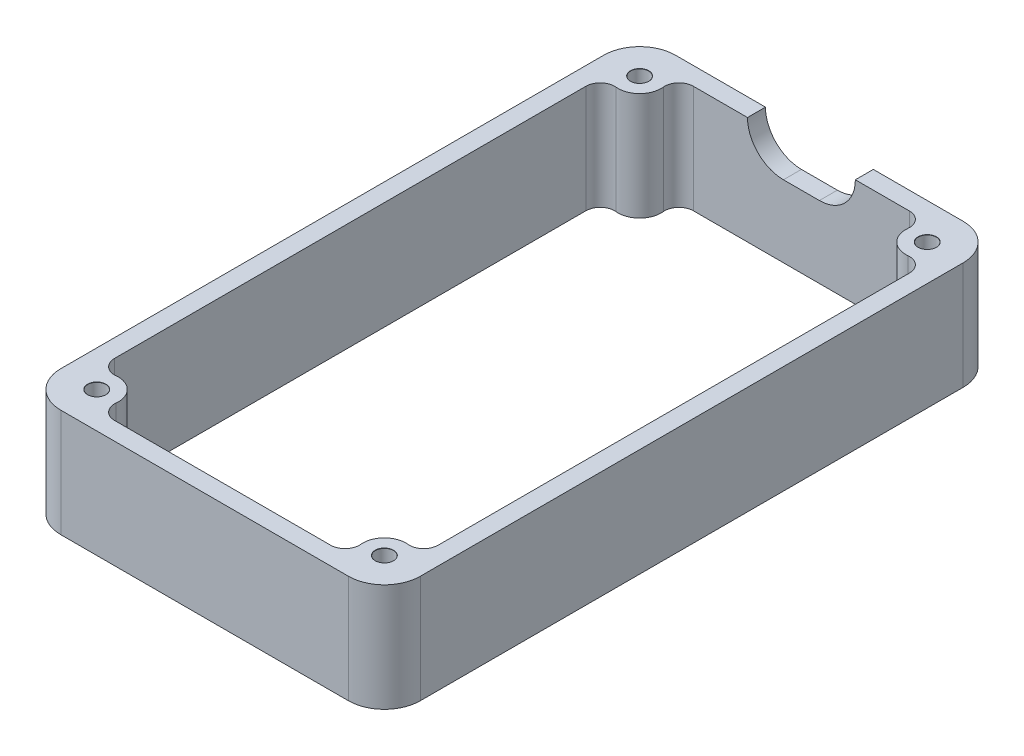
SolidWorks part; units mm, degrees
ref_plane "Front Plane" through (0, 0, 0) normal (0, 0, 1) x (1, 0, 0)
ref_plane "Top Plane" through (0, 0, 0) normal (0, 1, 0) x (1, 0, 0)
ref_plane "Right Plane" through (0, 0, 0) normal (1, 0, 0) x (0, 0, -1)
sketch "Sketch1" plane through (0, 0, 0) normal (0, 1, 0) x (1, 0, 0)
  line L1 (25, -42.75) -> (-25, -42.75)
  line L2 (25, -42.75) -> (25, 42.75)
  line L3 (25, 42.75) -> (-25, 42.75)
  line L4 (-25, -42.75) -> (-25, 42.75)
  line L5 (25, -42.75) -> (-25, 42.75) construction
  line L6 (25, 42.75) -> (-25, -42.75) construction
  point P0 (0, 0)
  dimension "D1" = 50
  dimension "D2" = 85.5
extrude "Boss-Extrude1" add sketch "Sketch1" along normal blind 15 contours L3 L4 L1 L2
fillet "Fillet1" radius 5 4 edges at (-25, 7.5, -42.75) (25, 7.5, -42.75) (25, 7.5, 42.75) (-25, 7.5, 42.75)
sketch "Sketch2" plane through (0, 15, 0) normal (0, 1, 0) x (1, 0, 0)
  line L1 (20, -37.75) -> (-20, -37.75) construction
  line L2 (20, -37.75) -> (20, 37.75) construction
  line L3 (20, 37.75) -> (-20, 37.75) construction
  line L4 (-20, -37.75) -> (-20, 37.75) construction
  line L5 (20, -37.75) -> (-20, 37.75) construction
  line L6 (20, 37.75) -> (-20, -37.75) construction
  point P0 (0, 0)
  dimension "D1" = 40
  dimension "D2" = 75.5
sketch "Sketch4" plane through (0, 15, 0) normal (0, 1, 0) x (1, 0, 0)
  line L0 (-20, -37.75) -> (-20, 37.75) construction
  line L1 (20, -37.75) -> (20, 37.75) construction
  line L10 (20, 40.25) -> (-20, 40.25)
  line L11 (-22.5, 37.75) -> (-22.5, -37.75)
  line L12 (-20, -40.25) -> (20, -40.25)
  line L13 (22.5, -37.75) -> (22.5, 37.75)
  line L14 (20, 40.25) -> (-20, 40.25)
  line L15 (-22.5, 37.75) -> (-22.5, -37.75)
  line L16 (-20, -40.25) -> (20, -40.25)
  line L17 (22.5, -37.75) -> (22.5, 37.75)
  circle A0 centre (-20, 37.75) radius 3
  circle A1 centre (20, 37.75) radius 3
  circle A2 centre (20, -37.75) radius 3
  circle A3 centre (-20, -37.75) radius 3
  circle A4 centre (-20, -37.75) radius 3
  circle A5 centre (20, -37.75) radius 3
  arc A14 (-20, 40.25) -> (-22.5, 37.75) centre (-20, 37.75) ccw
  arc A15 (-22.5, -37.75) -> (-20, -40.25) centre (-20, -37.75) ccw
  arc A16 (20, -40.25) -> (22.5, -37.75) centre (20, -37.75) ccw
  arc A17 (22.5, 37.75) -> (20, 40.25) centre (20, 37.75) ccw
  arc A18 (-20, 40.25) -> (-22.5, 37.75) centre (-20, 37.75) ccw
  arc A19 (-22.5, -37.75) -> (-20, -40.25) centre (-20, -37.75) ccw
  arc A20 (20, -40.25) -> (22.5, -37.75) centre (20, -37.75) ccw
  arc A21 (22.5, 37.75) -> (20, 40.25) centre (20, 37.75) ccw
  dimension "D3" = 6
  dimension "D1" = 75.5
  dimension "D2" = 75.5
  dimension "D4" = 2.5
extrude "Cut-Extrude1" cut sketch "Sketch4" against normal through all contours A5 L17 A1 L14 A0 L15 A4 A3 L16 A2
fillet "Fillet2" radius 2 8 edges at (-22.5, 7.5, 36.0917) (-18.3417, 7.5, 40.25) (22.5, 7.5, 36.0917) (18.3417, 7.5, 40.25) (22.5, 7.5, -36.0917) (18.3417, 7.5, -40.25) (-18.3417, 7.5, -40.25) (-22.5, 7.5, -36.0917)
sketch "Sketch6" plane through (0, 15, 0) normal (0, 1, 0) x (1, 0, 0)
  point P0 (-20, 37.75)
  point P3 (20, 37.75)
  point P6 (-20, -37.75)
  point P9 (20, -37.75)
  point P12 (-20, -37.75)
  point P15 (20, -37.75)
hole_wizard "Ø2.5 (2.5) Diameter Hole1" positions "Sketch6" profile "Sketch7" hole size "Ø2.5" standard "ANSI Metric"
sketch "Sketch7" plane through (-20, 15, -37.75) normal (1, 0, 0) x (0, 0, 1)
  line L0 (0, 0) -> (0, 15)
  line L1 (0, 15) -> (1.25, 15)
  line L2 (1.25, 15) -> (1.25, 0.025)
  line L3 (1.25, 0.025) -> (1.275, 0)
  line L5 (1.275, 0) -> (0, 0)
  line L6 (-1.25, 0.025) -> (-1.275, 0) construction
  line L11 (0, -6.35) -> (0, 107.95) construction
  dimension "Thru Hole Dia." = 2.5
  dimension "Thru Hole Depth" = 15
  dimension "Near C'Sink Dia." = 2.55
  dimension "Near C'Sink Angle" = 90
sketch "Sketch8" plane through (0, 0, -42.75) normal (0, 0, -1) x (-1, 0, 0)
  line L0 (-20, 15) -> (20, 15) construction
  line L1 (7.5, 20) -> (-7.5, 20)
  line L2 (7.5, 20) -> (7.5, 10)
  line L3 (7.5, 10) -> (-7.5, 10)
  line L4 (-7.5, 20) -> (-7.5, 10)
  line L5 (7.5, 20) -> (-7.5, 10) construction
  line L6 (7.5, 10) -> (-7.5, 20) construction
  point P0 (0, 15)
  dimension "D1" = 5
  dimension "D2" = 15
extrude "Cut-Extrude2" cut sketch "Sketch8" against normal blind 10
fillet "Fillet3" radius 5 2 edges at (-7.5, 10, -41.5) (7.5, 10, -41.5)
